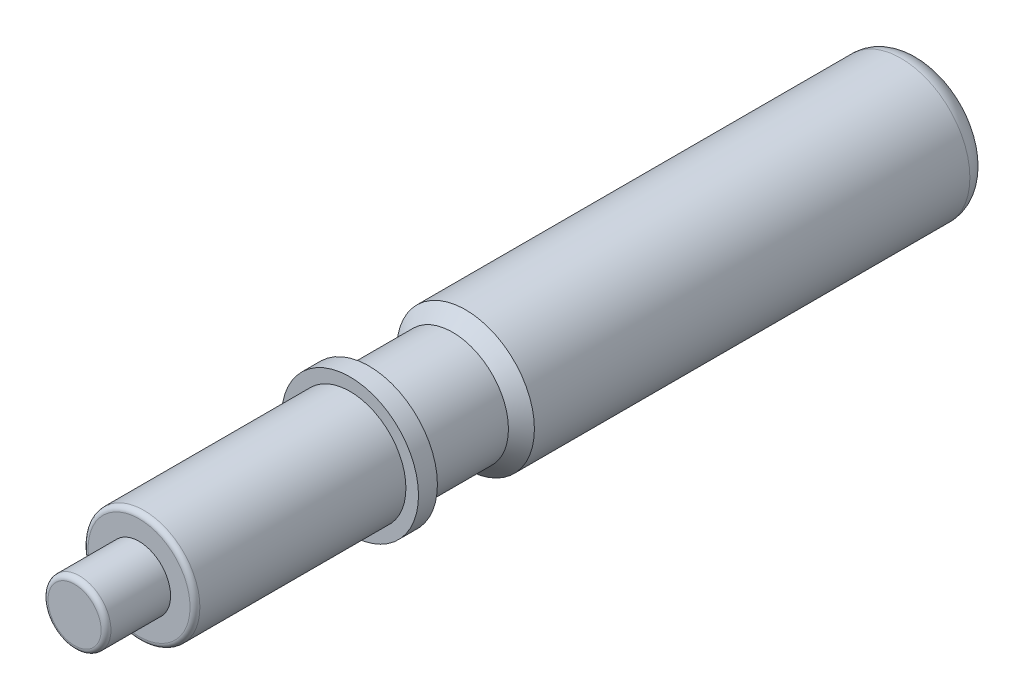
SolidWorks part; units mm, degrees
ref_plane "Спереди" through (0, 0, 0) normal (0, 0, 1) x (1, 0, 0)
ref_plane "Сверху" through (0, 0, 0) normal (0, 1, 0) x (1, 0, 0)
ref_plane "Справа" through (0, 0, 0) normal (1, 0, 0) x (0, 0, -1)
sketch "Эскиз1" plane through (0, 0, 0) normal (1, 0, 0) x (0, 0, -1)
  line L0 (0, 0) -> (58.2224, 0) construction
  line L1 (0, 0) -> (68.2625, 0)
  line L2 (68.2625, 0) -> (68.2625, 3.9687)
  line L3 (66.675, 5.5563) -> (31.5436, 5.5562)
  line L4 (31.5436, 5.5562) -> (30.4959, 4.5085)
  line L5 (30.4959, 4.5085) -> (23.749, 4.5085)
  line L6 (23.749, 4.5085) -> (23.749, 5.5245)
  line L7 (23.749, 5.5245) -> (22.225, 5.5245)
  line L8 (22.225, 5.5245) -> (22.225, 4.5085)
  line L9 (22.225, 4.5085) -> (5.6039, 4.5085)
  line L10 (5.207, 4.1116) -> (5.207, 2.54)
  line L11 (5.207, 2.54) -> (0.3969, 2.54)
  line L12 (0, 2.1431) -> (0, 0)
  arc A0 (68.2625, 3.9687) -> (66.675, 5.5563) centre (66.675, 3.9688) ccw
  arc A1 (0.3969, 2.54) -> (0, 2.1431) centre (0.3969, 2.1431) ccw
  arc A2 (5.6039, 4.5085) -> (5.207, 4.1116) centre (5.6039, 4.1116) ccw
  dimension "D11" = 1.5875
  dimension "D12" = 0.3969
  dimension "D13" = 0.3969
  dimension "D1" = 45
  dimension "D2" = 5.207
  dimension "D3" = 11.1125
  dimension "D4" = 9.017
  dimension "D5" = 11.049
  dimension "D6" = 5.08
  dimension "D7" = 22.225
  dimension "D8" = 6.7469
  dimension "D9" = 68.2625
  dimension "D10" = 1.524
revolve "Повернуть1" add sketch "Эскиз1" angle 360 about L0
